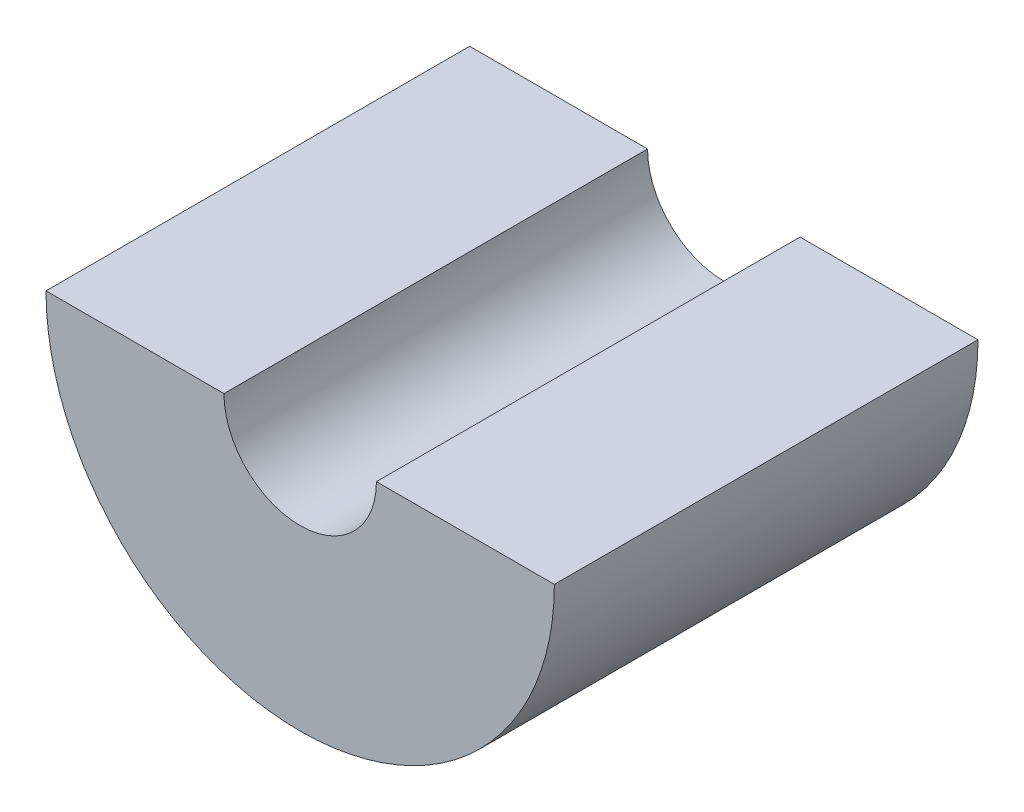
SolidWorks part; units mm, degrees
ref_plane "Face" through (0, 0, 0) normal (0, 0, 1) x (1, 0, 0)
ref_plane "Dessus" through (0, 0, 0) normal (0, 1, 0) x (1, 0, 0)
ref_plane "Droite" through (0, 0, 0) normal (1, 0, 0) x (0, 0, -1)
sketch "Esquisse1" plane through (0, 0, 0) normal (0, 0, 1) x (1, 0, 0)
  line L0 (-30, 0) -> (-9, 0)
  line L1 (9, 0) -> (30, 0)
  arc A0 (-30, 0) -> (30, 0) centre (0, 0) ccw
  arc A1 (-9, 0) -> (9, 0) centre (0, 0) ccw
  dimension "D1" = 60
  dimension "D2" = 18
extrude "Extrusion1" add sketch "Esquisse1" along normal blind 50
hole_wizard "Diamètre du perçage Ø8.0 (8)1" positions "Esquisse3D1" profile "Esquisse2" hole size "Ø8.0" standard "ISO"
sketch3d "Esquisse3D1"
  point P0 (0, -30, 25)
  dimension "D1" = 25
sketch "Esquisse2" plane through (0, -30, 25) normal (1, 0, 0) x (0, 0, -1)
  line L0 (0, 0) -> (0, 13.4034)
  line L1 (0, 13.4034) -> (4, 11)
  line L2 (4, 11) -> (4, 0)
  line L5 (4, 0) -> (0, 0)
  line L10 (0, 13.4034) -> (-4, 11) construction
  line L11 (0, -6.35) -> (0, 107.95) construction
  dimension "Diamètre du perçage" = 8
  dimension "Profondeur du perçage" = 11
  dimension "Angle de pointe" = 118
